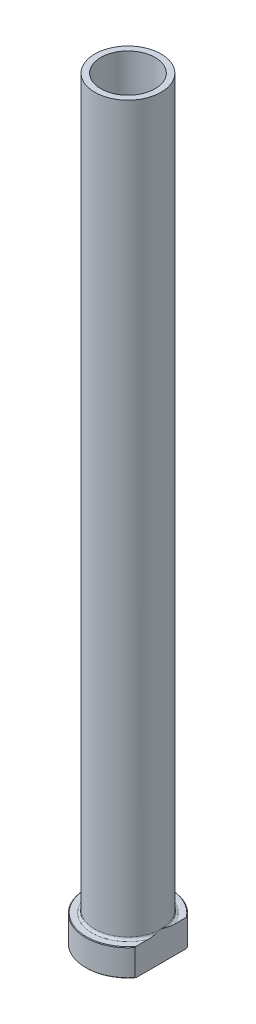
SolidWorks part; units mm, degrees
ref_plane "Front Plane" through (0, 0, 0) normal (0, 0, 1) x (1, 0, 0)
ref_plane "Top Plane" through (0, 0, 0) normal (0, 1, 0) x (1, 0, 0)
ref_plane "Right Plane" through (0, 0, 0) normal (1, 0, 0) x (0, 0, -1)
sketch "Sketch1" plane through (0, 0, 0) normal (0, 0, 1) x (1, 0, 0)
  line L0 (-9, 250) -> (-11, 250)
  line L1 (-11, 250) -> (-11, 9)
  line L2 (-11, 9) -> (-14, 9)
  line L3 (-14, 9) -> (-14, 0)
  line L4 (13.75, 0) -> (-13.75, 0) construction
  line L5 (-14, 0) -> (-9.25, 0)
  line L6 (-9, 195) -> (-9, 250)
  line L7 (0, 92.1877) -> (0, -15.5353) construction
  line L8 (0, -15.4) -> (0, 15.4) construction
  line L9 (-9, 195) -> (-9.25, 183)
  line L10 (-9.25, 183) -> (-9.25, 0)
  dimension "D1" = 0.25
  dimension "ID" = 18
  dimension "OD" = 22
  dimension "L" = 250
  dimension "H" = 28
  dimension "T" = 9
  dimension "N" = 55
  dimension "D2" = 12
  dimension "L-N" = 195
revolve "Revolve1" add sketch "Sketch1" angle 360 about L7
fillet "Fillet1" radius 0.8 1 edges at (0, 9, 11)
chamfer "Chamfer1" distance 0.2 angle 45 2 edges at (0, 9, 14) (0, 0, 14)
sketch "Sketch2" plane through (0, 0, 0) normal (0, -1, 0) x (1, 0, 0)
  line L0 (11, 8.6603) -> (11, -8.6603)
  circle A0 centre (0, 0) radius 14 construction
  arc A1 (11, 8.6603) -> (11, -8.6603) centre (0, 0) cw
  circle A2 centre (0, 0) radius 11 construction
extrude "Cut-Extrude1" cut sketch "Sketch2" against normal through all
chamfer "Chamfer2" distance 0.5 angle 45 1 edges at (0, 0, 9.25)
